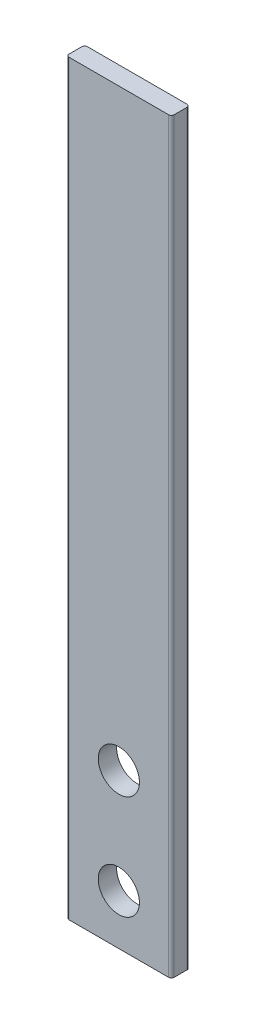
SolidWorks part; units mm, degrees
ref_plane "Front Plane" through (0, 0, 0) normal (0, 0, 1) x (1, 0, 0)
ref_plane "Top Plane" through (0, 0, 0) normal (0, 1, 0) x (1, 0, 0)
ref_plane "Right Plane" through (0, 0, 0) normal (1, 0, 0) x (0, 0, -1)
sketch "Sketch2" plane through (0, 0, 0) normal (0, 0, 1) x (1, 0, 0)
  line L1 (-4.8006, -34.1249) -> (4.8006, -34.1249)
  line L2 (-4.8006, -34.1249) -> (-4.8006, 34.1249)
  line L3 (-4.8006, 34.1249) -> (4.8006, 34.1249)
  line L4 (4.8006, -34.1249) -> (4.8006, 34.1249)
  line L5 (-4.8006, -34.1249) -> (4.8006, 34.1249) construction
  line L6 (-4.8006, 34.1249) -> (4.8006, -34.1249) construction
  point P0 (0, 0)
  dimension "D1" = 9.6012
  dimension "D2" = 68.2498
extrude "Boss-Extrude1" add sketch "Sketch2" against normal blind 1.6764
sketch "Sketch3" plane through (0, 0, 0) normal (0, 0, 1) x (1, 0, 0)
  line L0 (0, 0) -> (0, -50.8426) construction
  line L1 (-4.8006, -34.1249) -> (4.8006, -34.1249) construction
  circle A0 centre (0, -29.5529) radius 1.8796
  circle A1 centre (0, -20.0279) radius 1.8796
  dimension "D1" = 3.7592
  dimension "D2" = 9.525
  dimension "D3" = 4.572
extrude "Cut-Extrude1" cut sketch "Sketch3" against normal through all
fillet "Fillet1" radius 0.254 4 edges at (-4.8006, 0, -1.6764) (4.8006, 0, -1.6764) (4.8006, 0, 0) (-4.8006, 0, 0)
